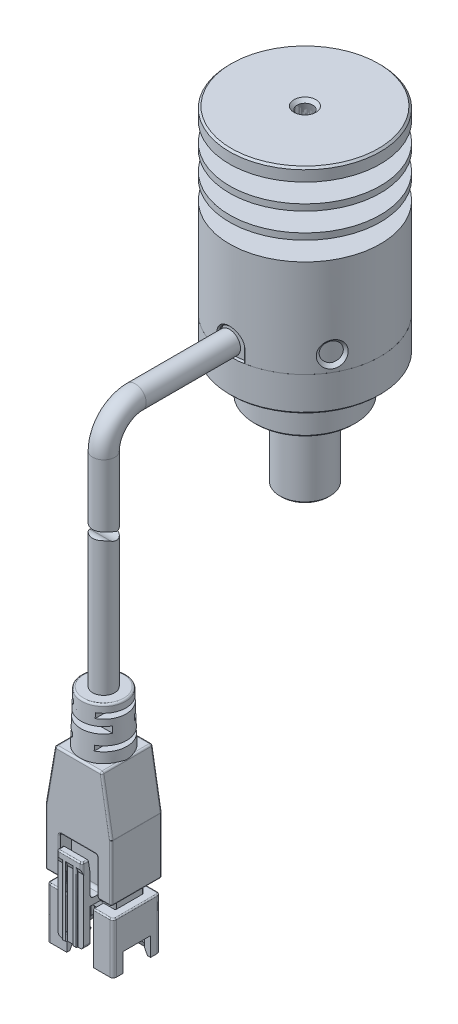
SolidWorks part; units mm, degrees
ref_plane "Front Plane" through (0, 0, 0) normal (0, 0, 1) x (1, 0, 0)
ref_plane "Top Plane" through (0, 0, 0) normal (0, 1, 0) x (1, 0, 0)
ref_plane "Right Plane" through (0, 0, 0) normal (1, 0, 0) x (0, 0, -1)
imported_body "P-NSPL-8-3-UV365-001-灯座-1-surface1"
imported_body "P-NSPL-8-3-UV365-001-灯座-1-surface2"
imported_body "P-NSPL-8-3-UV365-001-灯座-1-surface3"
imported_body "P-NSPL-8-3-UV365-001-灯座-1-surface4"
imported_body "P-NSPL-8-3-UV365-002-周圈-1-surface1"
imported_body "线材-1/1-1-surface1"
imported_body "线材-1/2-1-surface1"
sketch "草图1" plane through (0, 16, 0) normal (0, -1, 0) x (1, 0, 0)
  circle A0 centre (0, 0) radius 8 construction
  circle A1 centre (0, 0) radius 8
  circle A3 centre (0, 0) radius 11.5
  dimension "D1" = 23
extrude "凸台-拉伸1" add sketch "草图1" against normal blind 20
sketch "草图2" plane through (0, 37, 0) normal (0, 1, 0) x (1, 0, 0)
  circle A0 centre (0, 0) radius 4.5 construction
  circle A1 centre (0, 0) radius 4.5
  circle A2 centre (0, 0) radius 1.25 construction
  circle A3 centre (0, 0) radius 1.25
extrude "凸台-拉伸2" add sketch "草图2" along normal blind 12.5 separate body
